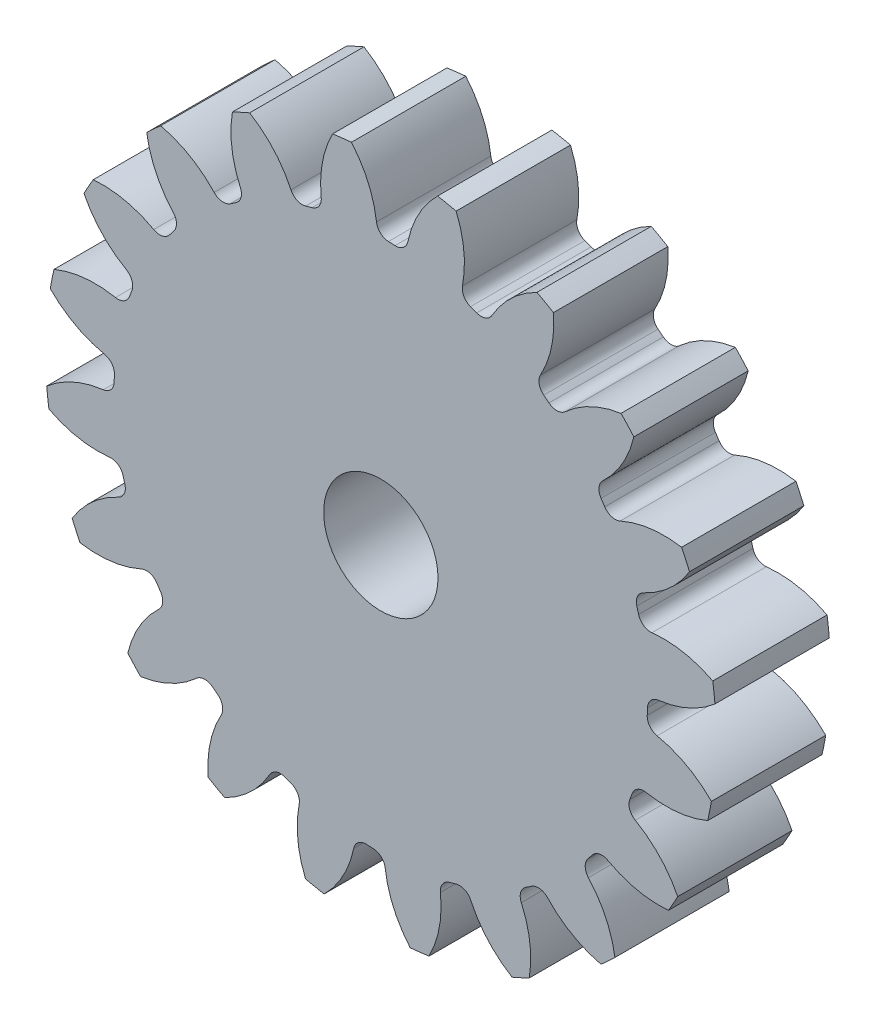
SolidWorks part; units mm, degrees
ref_plane "Front" through (0, 0, 0) normal (0, 0, 1) x (1, 0, 0)
ref_plane "Top" through (0, 0, 0) normal (0, 1, 0) x (1, 0, 0)
ref_plane "Right" through (0, 0, 0) normal (1, 0, 0) x (0, 0, -1)
sketch "Sketch3" plane through (0, 0, 0) normal (0, 0, 1) x (1, 0, 0)
  circle A0 centre (0, 0) radius 372.5333
  dimension "od" = 745.0667
extrude "gearBody" add sketch "Sketch3" along normal blind 127
sketch "Sketch2" plane through (0, 0, 0) normal (0, 0, 1) x (1, 0, 0)
  line L0 (0, 0) -> (294.0178, 121.7862) construction
  line L1 (368.4953, -64.3547) -> (0, 0) construction
  line L2 (0, 0) -> (36.3143, 0) construction
  line L3 (338.4312, 12.6259) -> (336.254, -40.3533) construction
  line L5 (337.3426, -13.8637) -> (0, 0) construction
  line L7 (0, 0) -> (318.2426, 0) construction
  arc A0 (318.1774, 6.4396) -> (316.5761, -32.5259) centre (0, 0) ccw construction
  arc A1 (371.1005, 32.6415) -> (367.1707, -62.9821) centre (0, 0) ccw construction
  arc A2 (338.4312, 12.6259) -> (336.254, -40.3533) centre (0, 0) ccw construction
  arc A3 (295.9089, -15.8542) -> (296.212, -8.4801) centre (0, 0) ccw
  arc A4 (368.4953, -64.3547) -> (306.8834, -30.0902) centre (283.0331, -145.5011) ccw
  arc A5 (368.4953, -64.3547) -> (372.5333, 33.9008) centre (0, 0) ccw
  arc A6 (372.5333, 33.9008) -> (308.3176, 4.8074) centre (294.0178, 121.7862) cw
  arc A7 (296.212, -8.4801) -> (308.3176, 4.8074) centre (309.9901, -8.8745) cw
  arc A8 (306.8834, -30.0902) -> (295.9089, -15.8542) centre (309.6729, -16.5916) cw
  point P6 (372.5333, 33.9008)
  point P22 (368.4953, -64.3547)
  dimension "baseDia" = 636.4851
  dimension "od" = 745.0667
  dimension "pd" = 677.3333
  dimension "rd" = 592.6667
  dimension "rFillet" = 13.7837
  dimension "pointX" = 372.5333
  dimension "pointY" = 33.9008
  dimension "CTT" = 52.9791
  dimension "flankCenterAngle" = 22.5
extrude "toothCut" cut sketch "Sketch2" along normal through all
pattern_circular "CirPattern1" count 20 over 360 about axis through (0, 0, 0) along (0, 0, 1) of "toothCut"
sketch "hub1Dia" plane through (0, 0, 0) normal (0, 0, -1) x (-1, 0, 0)
  circle A0 centre (0, 0) radius 12.7
  dimension "hub1Dia" = 25.4
sketch "hub2Dia" plane through (0, 0, 127) normal (0, 0, 1) x (1, 0, 0)
  circle A0 centre (0, 0) radius 12.7
  dimension "hub2dia" = 25.4
sketch "boreDia" plane through (0, 0, 0) normal (0, 0, 1) x (1, 0, 0)
  circle A0 centre (0, 0) radius 63.5
  dimension "boreDia" = 127
extrude "bore" cut sketch "boreDia" against normal mid plane 25400
